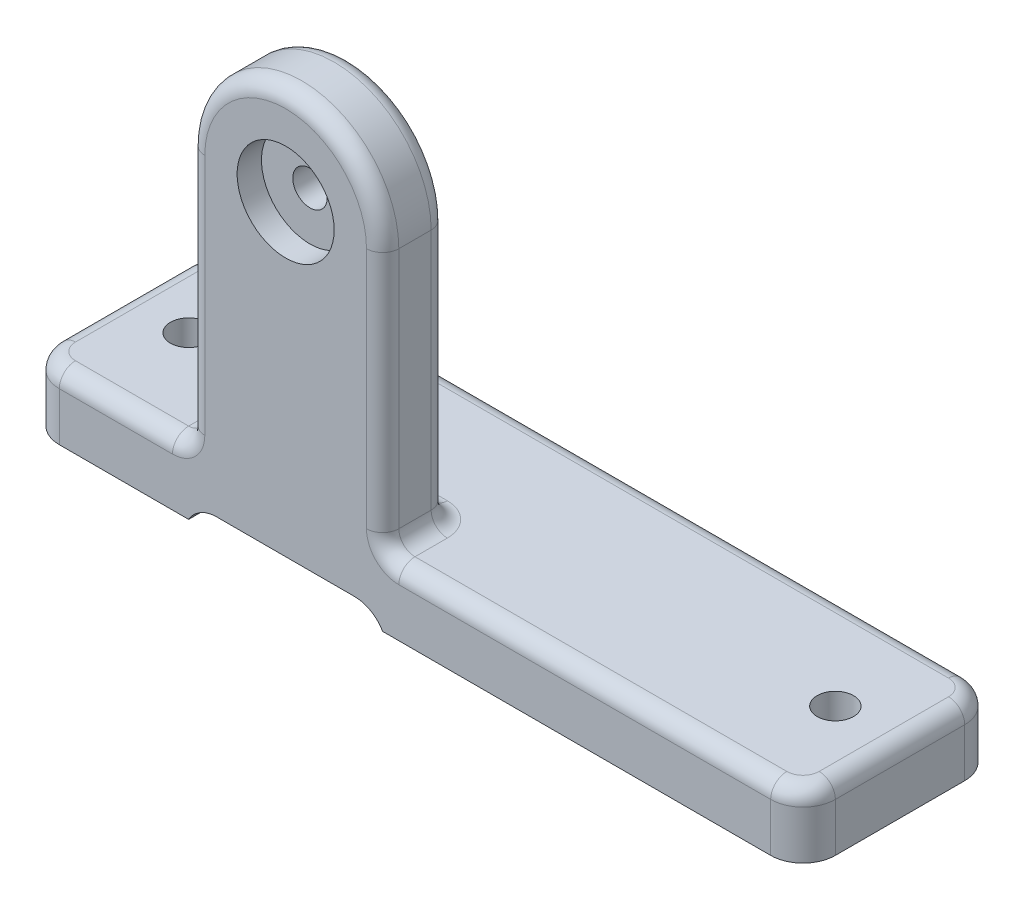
SolidWorks part; units mm, degrees
ref_plane "Front Plane" through (0, 0, 0) normal (0, 0, 1) x (1, 0, 0)
ref_plane "Top Plane" through (0, 0, 0) normal (0, 1, 0) x (1, 0, 0)
ref_plane "Right Plane" through (0, 0, 0) normal (1, 0, 0) x (0, 0, -1)
sketch "Sketch1" plane through (0, 0, 0) normal (0, 1, 0) x (1, 0, 0)
  line L1 (0, 0) -> (152.4, 0)
  line L2 (0, 0) -> (0, 38.1)
  line L3 (0, 38.1) -> (152.4, 38.1)
  line L4 (152.4, 0) -> (152.4, 38.1)
  dimension "D1" = 152.4
  dimension "D2" = 38.1
extrude "Base Plate" add sketch "Sketch1" along normal blind 12.7
sketch "Sketch2" plane through (0, 0, 0) normal (0, 0, 1) x (1, 0, 0)
  line L0 (31.75, 0) -> (31.75, 63.5)
  line L1 (0, 0) -> (152.4, 0) construction
  line L2 (69.85, 63.5) -> (69.85, 0)
  line L3 (69.85, 0) -> (31.75, 0)
  line L4 (0, 12.7) -> (0, 0) construction
  arc A0 (31.75, 63.5) -> (69.85, 63.5) centre (50.8, 63.5) cw
  dimension "D1" = 19.05
  dimension "D2" = 50.8
  dimension "D3" = 63.5
extrude "Vert Boss" add sketch "Sketch2" against normal blind 12.7
hole_wizard "CBORE for 1/4 Hex Head Bolt1" positions "Sketch4" profile "Sketch3" counterbore size "1/4" standard "Ansi Inch"
sketch "Sketch4" plane through (0, 0, 0) normal (0, 0, 1) x (1, 0, 0)
  point P0 (50.8, 63.5)
sketch "Sketch3" plane through (50.8, 63.5, 0) normal (1, 0, 0) x (0, -1, 0)
  line L0 (0, 0) -> (0, 38.1)
  line L1 (0, 38.1) -> (3.3782, 38.1)
  line L3 (3.3782, 38.1) -> (3.3782, 4.7752)
  line L4 (3.3782, 4.7752) -> (9.525, 4.7752)
  line L5 (9.525, 4.7752) -> (9.525, 0)
  line L7 (9.525, 0) -> (0, 0)
  line L11 (0, -6.35) -> (0, 107.95) construction
  dimension "Thru Hole Dia." = 6.7564
  dimension "Thru Hole Depth" = 38.1
  dimension "C'Bore Dia." = 19.05
  dimension "C'Bore Depth" = 4.7752
sketch "Sketch5" plane through (0, 0, 0) normal (0, 0, 1) x (1, 0, 0)
  line L0 (0, 0) -> (152.4, 0) construction
  line L1 (31.75, 0) -> (69.85, 0)
  line L2 (31.75, 0) -> (31.75, 3.175)
  line L3 (31.75, 3.175) -> (69.85, 3.175)
  line L4 (69.85, 0) -> (69.85, 3.175)
  line L5 (31.75, 63.5) -> (31.75, 12.7) construction
  line L6 (69.85, 12.7) -> (69.85, 63.5) construction
  dimension "D1" = 3.175
extrude "Base Holes" cut sketch "Sketch5" against normal through all
hole_wizard "9/32 (0.28125) Diameter Hole1" positions "Sketch7" profile "Sketch6" hole size "9/32" standard "Ansi Inch"
sketch "Sketch7" plane through (0, 12.7, 0) normal (0, 1, 0) x (-1, 0, 0)
  line L0 (0, -38.1) -> (0, 0) construction
  line L1 (-152.4, 0) -> (-152.4, -38.1) construction
  line L2 (-152.4, -38.1) -> (0, -38.1) construction
  point P0 (-139.7, -19.05)
  point P1 (-12.7, -19.05)
  dimension "D1" = 12.7
  dimension "D2" = 12.7
  dimension "D3" = 19.05
sketch "Sketch6" plane through (139.7, 12.7, -19.05) normal (1, 0, 0) x (0, 0, 1)
  line L0 (0, 0) -> (0, 12.7)
  line L1 (0, 12.7) -> (3.5719, 12.7)
  line L2 (3.5719, 12.7) -> (3.5719, 0)
  line L5 (3.5719, 0) -> (0, 0)
  line L11 (0, -6.35) -> (0, 107.95) construction
  dimension "Thru Hole Dia." = 7.1437
  dimension "Thru Hole Depth" = 12.7
fillet "Fillet1" radius 6.35 6 edges at (69.85, 3.175, -19.05) (31.75, 3.175, -19.05) (0, 6.35, 0) (0, 6.35, -38.1) (152.4, 6.35, -38.1) (152.4, 6.35, 0)
fillet "Fillet2" radius 3.175 18 edges at (1.8599, 12.7, -36.2401) (0, 12.7, -19.05) (76.2, 12.7, -38.1) (1.8599, 12.7, -1.8599) (150.5401, 12.7, -36.2401) (19.05, 12.7, 0) (152.4, 12.7, -19.05) (31.75, 12.7, -6.35) (150.5401, 12.7, -1.8599) (50.8, 12.7, -12.7) (107.95, 12.7, 0) (69.85, 38.1, -12.7) (31.75, 38.1, -12.7) (69.85, 38.1, 0) (31.75, 38.1, 0) (69.85, 12.7, -6.35) (50.8, 82.55, -12.7) (50.8, 82.55, 0)
